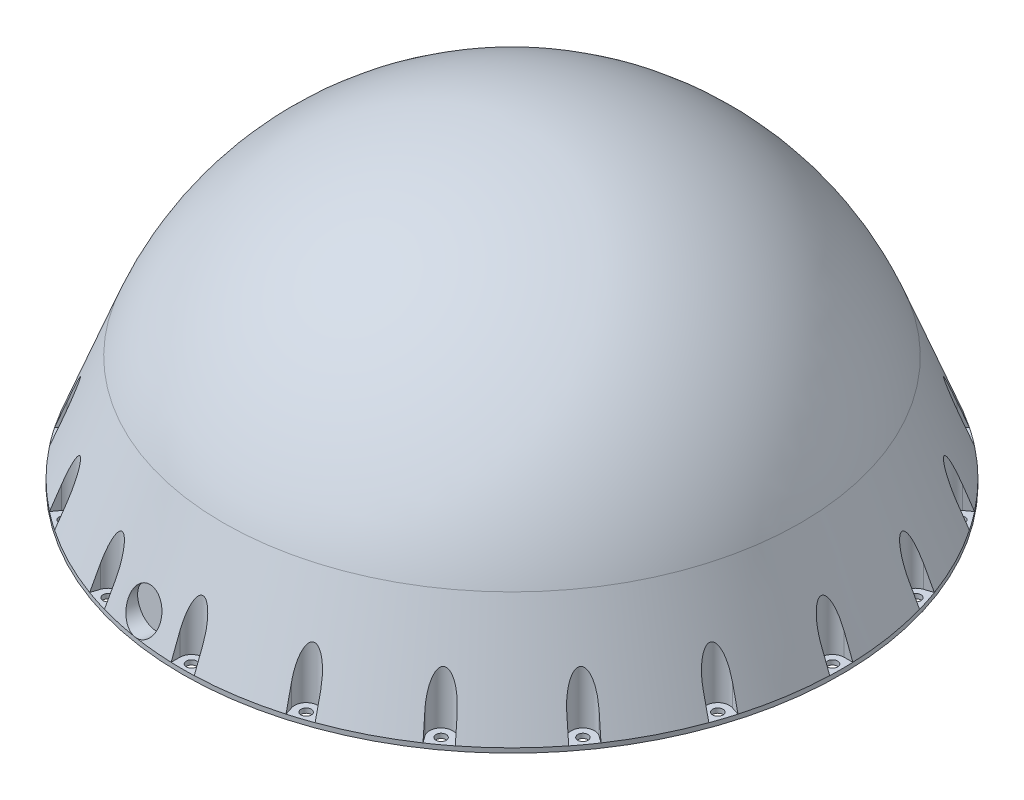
SolidWorks part; units mm, degrees
ref_plane "Front" through (0, 0, 0) normal (0, 0, 1) x (1, 0, 0)
ref_plane "Top" through (0, 0, 0) normal (0, 1, 0) x (1, 0, 0)
ref_plane "Right" through (0, 0, 0) normal (1, 0, 0) x (0, 0, -1)
sketch "Sketch1" plane through (0, 0, 0) normal (0, 0, 1) x (1, 0, 0)
  line L0 (0, 0) -> (0, 180.6647) construction
  line L1 (161.544, 0) -> (180.975, 0)
  line L2 (180.975, 0) -> (180.975, 2.54)
  line L3 (180.975, 2.54) -> (158.5779, 60.8795)
  line L4 (161.544, 34.0815) -> (161.544, 0)
  line L5 (0, 169.8625) -> (0, 165.1)
  arc A0 (158.5779, 60.8795) -> (0, 169.8625) centre (0, 0) ccw
  arc A1 (161.544, 34.0815) -> (0, 165.1) centre (0, 0) ccw
  dimension "D1" = 339.725
  dimension "D4" = 330.2
  dimension "D2" = 180.975
  dimension "D3" = 2.54
  dimension "D5" = 161.544
  dimension "D6" = 169.8625
revolve "Revolve1" add sketch "Sketch1" angle 360 about L5
ref_plane "Plane1" through (0, 2.54, 0) normal (0, 1, 0) x (-1, 0, 0)
sketch "Sketch2" plane through (0, 2.54, 0) normal (0, 1, 0) x (-1, 0, 0)
  line L0 (0, 0) -> (176.0728, 0) construction
  circle A0 centre (176.0728, 0) radius 2.8067
  dimension "D2" = 5.6134
  dimension "D1" = 176.0728
extrude "Cut-Extrude1" cut sketch "Sketch2" against normal through all and the other way through all
pattern_circular "CirPattern1" count 20 over 360 about axis through (0, 0, 0) along (0, 1, 0) of "Cut-Extrude1"
sketch "Sketch3" plane through (0, 2.54, 0) normal (0, 1, 0) x (-1, 0, 0)
  line L1 (176.0728, 6.35) -> (184.4578, 6.35)
  line L3 (176.0728, -6.35) -> (184.4578, -6.35)
  line L4 (184.4578, 6.35) -> (184.4578, -6.35)
  arc A0 (176.0728, 6.35) -> (176.0728, -6.35) centre (176.0728, 0) ccw
  dimension "D1" = 12.7
extrude "Cut-Extrude2" cut sketch "Sketch3" along normal through all
pattern_circular "CirPattern2" count 20 over 360 about axis through (0, 0, 0) along (0, 1, 0) of "Cut-Extrude2"
sketch "Sketch6" plane through (0, 0, 0) normal (0, 1, 0) x (1, 0, 0)
  line L0 (0, -176.0728) -> (-54.4095, -167.4552) construction
  line L1 (-27.2047, -171.764) -> (-28.3107, -178.7469) construction
  arc A0 (-49.8507, -173.9737) -> (-6.35, -180.8636) centre (0, 0) ccw construction
ref_plane "Plane3" through (0, 0, 0) normal (-0.1564, 0, 0.9877) x (0.9877, 0, 0.1564)
ref_plane "Plane4" through (-28.3107, 0, 178.7469) normal (-0.1564, 0, 0.9877) x (0.9877, 0, 0.1564)
sketch "Sketch7" plane through (-28.3107, 0, 178.7469) normal (-0.1564, 0, 0.9877) x (0.9877, 0, 0.1564)
  line L0 (0, 2.54) -> (0, 60.8795) construction
  line L1 (-22.0215, 2.54) -> (22.0215, 2.54) construction
  circle A0 centre (0, 13.0556) radius 10.5156
  dimension "D1" = 21.0312
extrude "Cut-Extrude3" cut sketch "Sketch7" against normal blind 8.89
